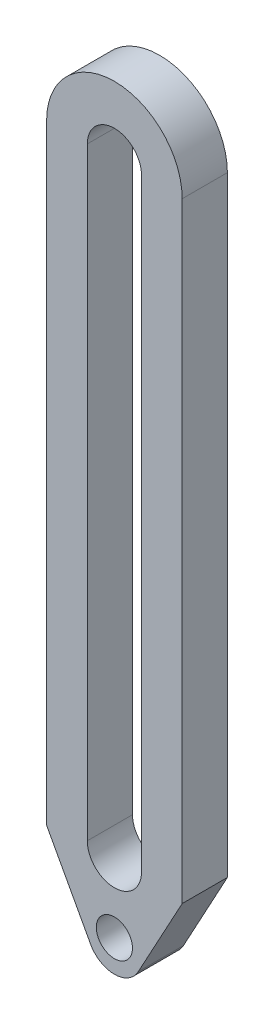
SolidWorks part; units mm, degrees
ref_plane "Front Plane" through (0, 0, 0) normal (0, 0, 1) x (1, 0, 0)
ref_plane "Top Plane" through (0, 0, 0) normal (0, 1, 0) x (1, 0, 0)
ref_plane "Right Plane" through (0, 0, 0) normal (1, 0, 0) x (0, 0, -1)
sketch "Sketch1" plane through (0, 0, 0) normal (0, 0, 1) x (1, 0, 0)
  line L0 (-1.598, -9.6575) -> (-1.598, 57.8757)
  line L5 (-16.598, 57.8757) -> (-16.598, -9.6575)
  line L6 (-6.098, -8.8934) -> (-6.098, 57.8757)
  line L7 (-12.098, 57.8757) -> (-12.098, -8.8934)
  line L9 (-1.598, -9.6575) -> (-6.4614, -18.6169)
  line L10 (-11.7346, -18.6169) -> (-16.598, -9.6575)
  arc A4 (-1.598, 57.8757) -> (-16.598, 57.8757) centre (-9.098, 57.8757) ccw
  arc A7 (-6.098, 57.8757) -> (-12.098, 57.8757) centre (-9.098, 57.8757) ccw
  arc A8 (-12.098, -8.8934) -> (-6.098, -8.8934) centre (-9.098, -8.8934) ccw
  circle A9 centre (-9.098, -16.6857) radius 2
  arc A10 (-6.4614, -18.6169) -> (-11.7346, -18.6169) centre (-9.098, -17.1857) cw
  point P21 (-9.098, -23.474)
  point P28 (-9.098, -20.1857)
  dimension "D1" = 4
  dimension "D4" = 3
  dimension "D2" = 6
  dimension "D3" = 15
  dimension "D5" = 67.5332
  dimension "D6" = 3.5
  dimension "D7" = 6
extrude "Boss-Extrude1" add sketch "Sketch1" along normal blind 5
